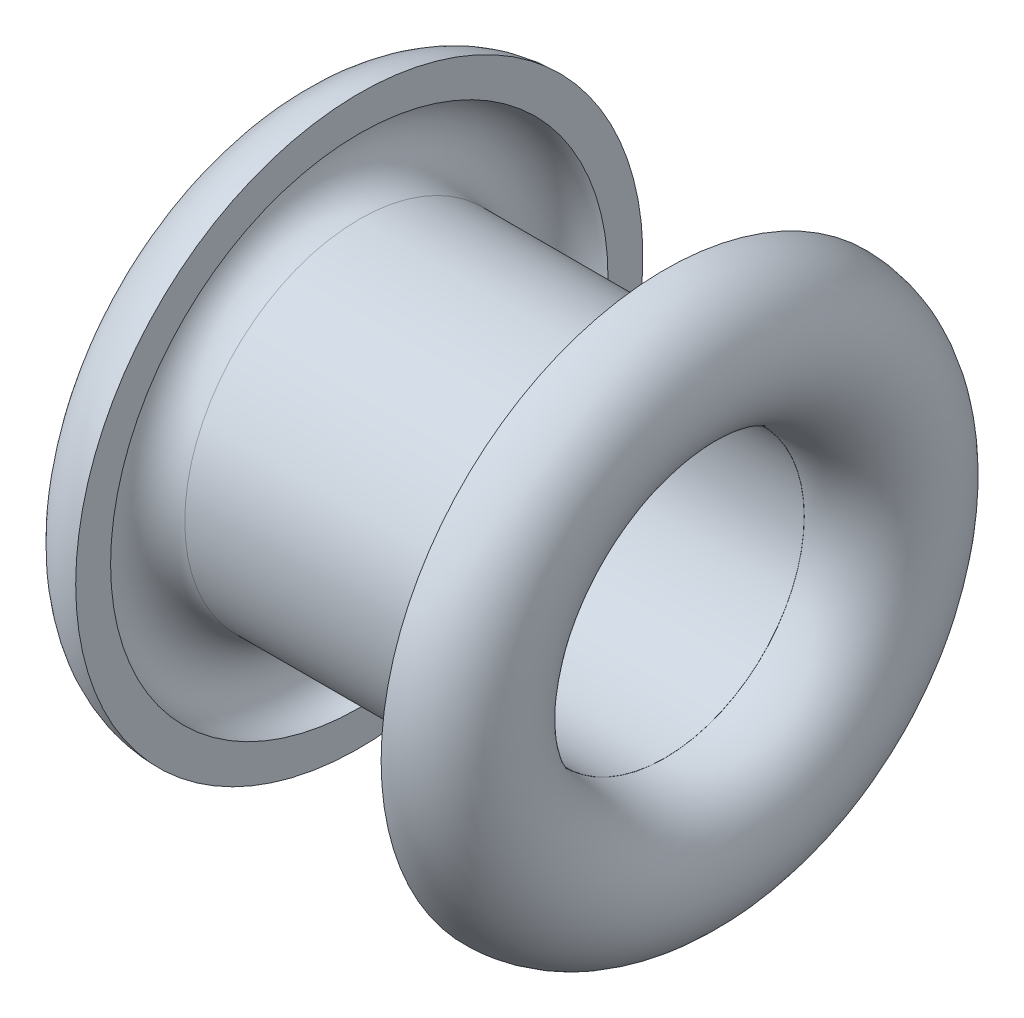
SolidWorks part; units mm, degrees
ref_plane "Plan de face" through (0, 0, 0) normal (0, 0, 1) x (1, 0, 0)
ref_plane "Plan de dessus" through (0, 0, 0) normal (0, 1, 0) x (1, 0, 0)
ref_plane "Plan de droite" through (0, 0, 0) normal (1, 0, 0) x (0, 0, -1)
sketch "Esquisse1" plane through (0, 0, 0) normal (0, 0, 1) x (1, 0, 0)
  line L0 (0, 0) -> (5.996, 0) construction
  line L1 (0, 2) -> (0, 1.6)
  line L3 (0, 0) -> (0, 6.3668) construction
  line L5 (-1.2113, 2.425) -> (4.8231, 2.425) construction
  line L7 (0, 3.25) -> (0, 2.85)
  arc A0 (0, 3.25) -> (0, 1.6) centre (0, 2.425) ccw
  arc A1 (0, 2.85) -> (0, 2) centre (0, 2.425) ccw
  dimension "D3" = 0.825
  dimension "D1" = 0.4
  dimension "D2" = 2
revolve "Révolution1" add sketch "Esquisse1" angle 360 about L0
sketch "Esquisse2" plane through (0, 0, 0) normal (1, 0, 0) x (0, 0, -1)
  circle A0 centre (0, 0) radius 2
  circle A1 centre (0, 0) radius 1.5983
extrude "Extrusion1" add sketch "Esquisse2" along normal blind 1.75
mirror "Symétrie1" about plane through (1.75, 0, 0) normal (1, 0, 0)
